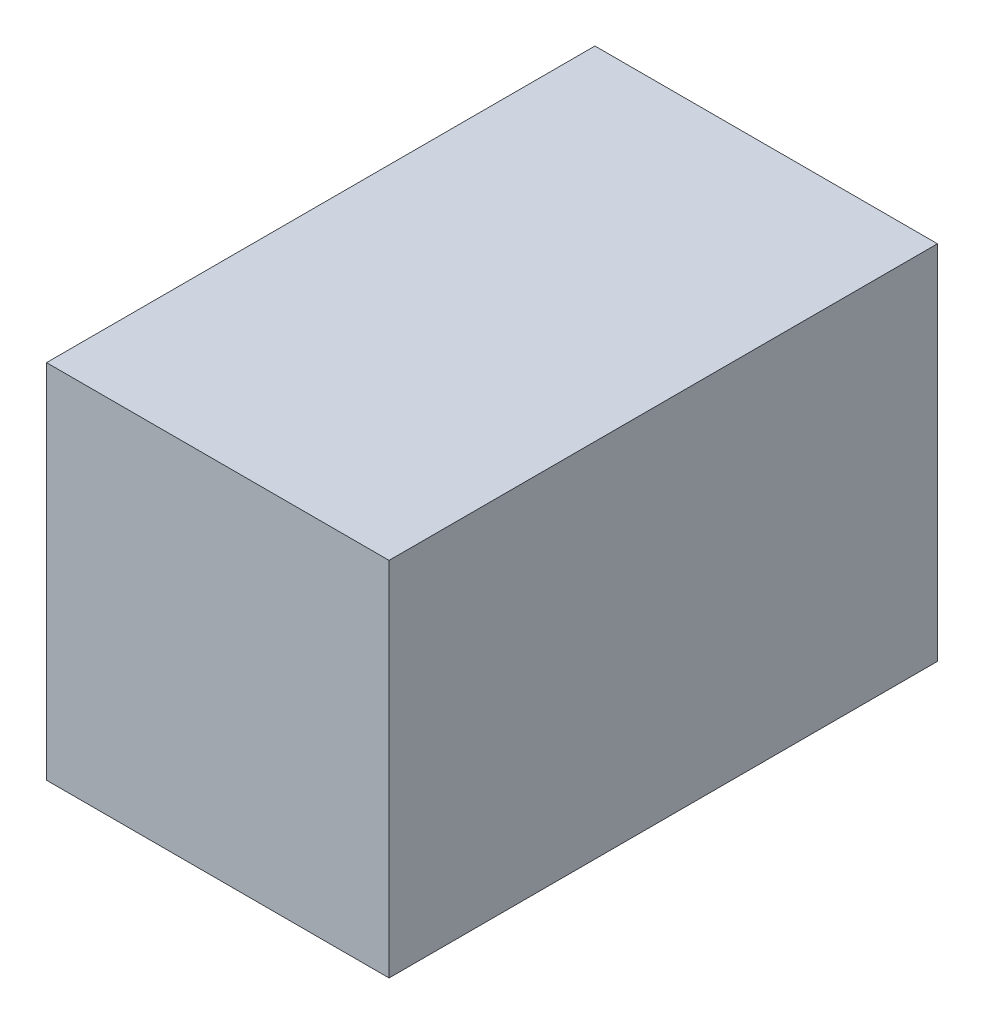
SolidWorks part; units mm, degrees
ref_plane "Front Plane" through (0, 0, 0) normal (0, 0, 1) x (1, 0, 0)
ref_plane "Top Plane" through (0, 0, 0) normal (0, 1, 0) x (1, 0, 0)
ref_plane "Right Plane" through (0, 0, 0) normal (1, 0, 0) x (0, 0, -1)
sketch "Sketch1" plane through (0, 0, 0) normal (0, 1, 0) x (1, 0, 0)
  line L1 (-34.5048, -381) -> (37.6617, -381)
  line L2 (-34.5048, -381) -> (-34.5048, -496.5425)
  line L3 (-34.5048, -496.5425) -> (37.6617, -496.5425)
  line L4 (37.6617, -381) -> (37.6617, -496.5425)
  dimension "D1" = 381
extrude "Extrude1" add sketch "Sketch1" along normal mid plane 76.2
